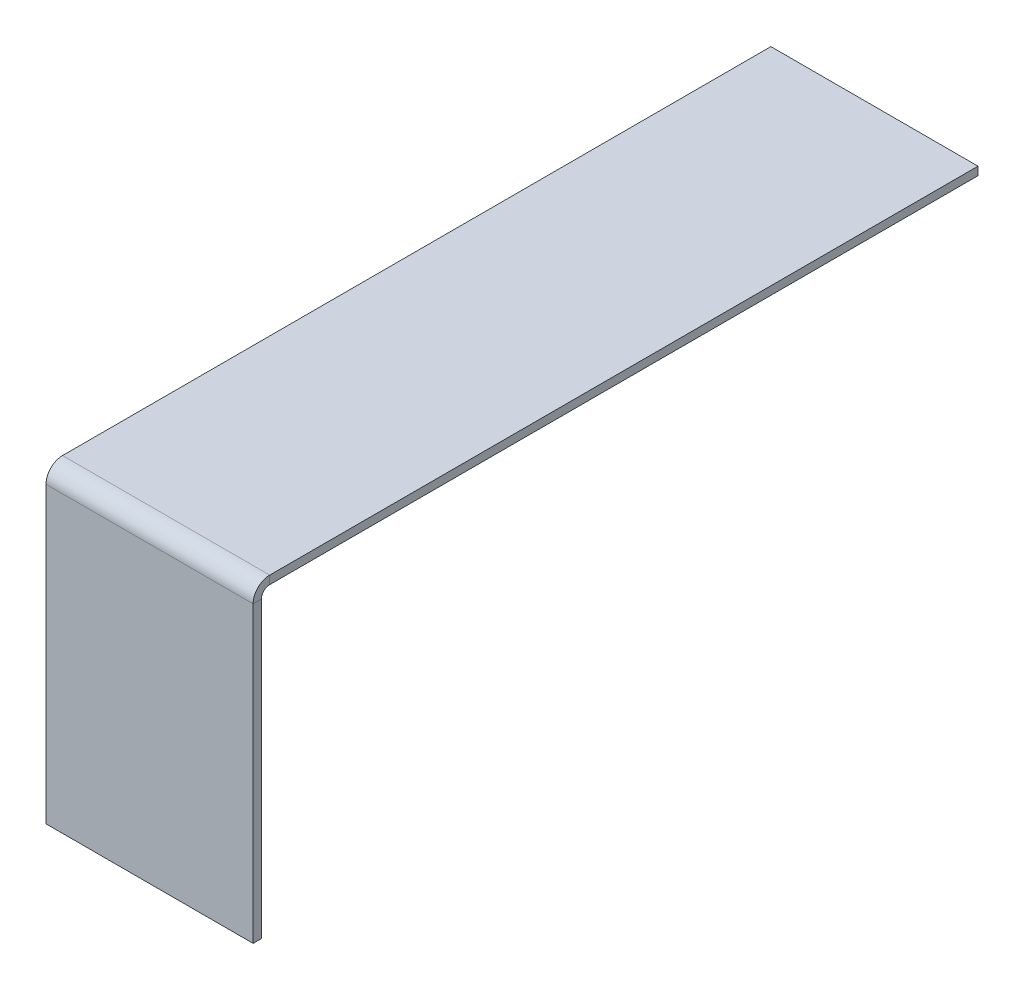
SolidWorks part; units mm, degrees
ref_plane "vorne" through (0, 0, 0) normal (0, 0, 1) x (1, 0, 0)
ref_plane "0.00" through (0, 0, 0) normal (0, 1, 0) x (1, 0, 0)
ref_plane "mitte" through (0, 0, 0) normal (1, 0, 0) x (0, 0, -1)
body saved out of another part "Basisteil-schweiskonstruktion mit blech-1"
sheet metal parameters "Blech1" parameters "D1"=1, "Dicke"=2
bend "Biegung-Rundung1" bend radius 2 bend angle 90 parameters "D5"=1
flatten bends "Abwickeln1"
sketch "Skizze-Winkel1" plane through (0, 0, 0) normal (0, 0, 1) x (1, 0, 0)
  line L0 (-25, 98.2777) -> (25, 98.2777) construction
  dimension "D1" = 0
process bends "Abbiegen1" parameters "D1"=0
sketch "Abwicklung-Skizze1" plane through (0, 0, 0) normal (0, 0, 1) x (1, 0, 0)
flat pattern "Abwicklung1"
sketch "Biegung-Linien1" plane through (0, 0, 0) normal (0, 0, 1) x (1, 0, 0)
  line L0 (25, 98.2777) -> (-25, 98.2777) construction
  line L1 (25, 98.2777) -> (-25, 98.2777) construction
bend of the flat pattern "Abwickeln-<Biegung-Rundung1>1"
